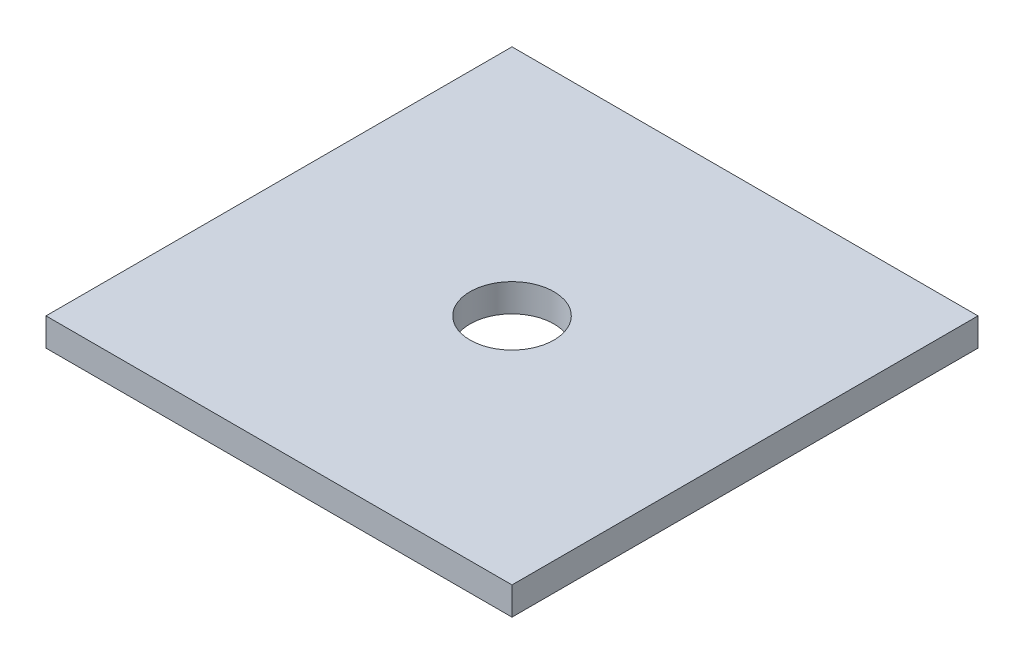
SolidWorks part; units mm, degrees
ref_plane "Front Plane" through (0, 0, 0) normal (0, 0, 1) x (1, 0, 0)
ref_plane "Top Plane" through (0, 0, 0) normal (0, 1, 0) x (1, 0, 0)
ref_plane "Right Plane" through (0, 0, 0) normal (1, 0, 0) x (0, 0, -1)
sketch "Sketch1" plane through (0, 0, 0) normal (0, 1, 0) x (1, 0, 0)
  line L0 (50, 50) -> (0, 0) construction
  line L1 (0, 0) -> (50, 0)
  line L2 (0, 0) -> (0, 50)
  line L3 (0, 50) -> (50, 50)
  line L4 (50, 0) -> (50, 50)
  circle A0 centre (25, 25) radius 4.5
  dimension "D2" = 9
  dimension "D1" = 50
extrude "Extrude1" add sketch "Sketch1" along normal blind 3
